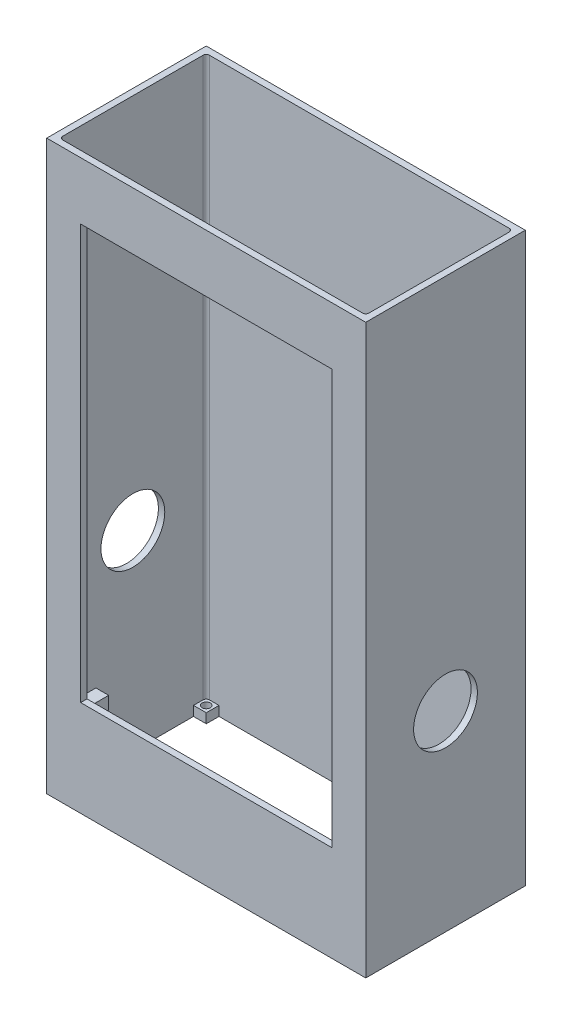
SolidWorks part; units mm, degrees
ref_plane "Front Plane" through (0, 0, 0) normal (0, 0, 1) x (1, 0, 0)
ref_plane "Top Plane" through (0, 0, 0) normal (0, 1, 0) x (1, 0, 0)
ref_plane "Right Plane" through (0, 0, 0) normal (1, 0, 0) x (0, 0, -1)
sketch "Sketch1" plane through (0, 0, 0) normal (0, 1, 0) x (1, 0, 0)
  line L1 (0, 0) -> (127, 0)
  line L2 (0, 0) -> (0, 63.5)
  line L3 (0, 63.5) -> (127, 63.5)
  line L4 (127, 0) -> (127, 63.5)
extrude "Boss-Extrude1" add sketch "Sketch1" against normal blind 302.26
sketch "Sketch2" plane through (0, -302.26, 0) normal (0, -1, 0) x (1, 0, 0)
  line L0 (0, -63.5) -> (0, -60.96)
  line L1 (0, -63.5) -> (0, 0) construction
  line L2 (0, -60.96) -> (2.54, -60.96)
  line L3 (127, 0) -> (127, -2.54)
  line L4 (127, 0) -> (127, -63.5) construction
  line L5 (127, -2.54) -> (124.46, -2.54)
  line L7 (2.54, -60.96) -> (124.46, -60.96)
  line L8 (2.54, -60.96) -> (2.54, -2.54)
  line L9 (2.54, -2.54) -> (124.46, -2.54)
  line L10 (124.46, -60.96) -> (124.46, -2.54)
extrude "Cut-Extrude1" cut sketch "Sketch2" against normal blind 299.72 contours L7 L10 L9 L8
fillet "Fillet3" radius 1.27 1 edges at (2.54, -152.4, -60.96)
fillet "Fillet4" radius 1.27 1 edges at (2.54, -152.4, -2.54)
fillet "Fillet5" radius 1.27 1 edges at (124.46, -152.4, -2.54)
fillet "Fillet6" radius 1.27 1 edges at (124.46, -152.4, -60.96)
sketch "Sketch3" plane through (0, 0, 0) normal (-1, 0, 0) x (0, 0, 1)
  line L0 (-63.5, -302.26) -> (-31.75, -302.26)
  line L1 (-63.5, -302.26) -> (0, -302.26) construction
  line L2 (-31.75, -302.26) -> (-31.75, -152.4)
  circle A0 centre (-31.75, -152.4) radius 12.7
extrude "Cut-Extrude3" cut sketch "Sketch3" against normal blind 254
sketch "Sketch4" plane through (0, 0, 0) normal (0, 1, 0) x (1, 0, 0)
  line L1 (0, 0) -> (127, 0)
  line L2 (0, 0) -> (0, 63.5)
  line L3 (0, 63.5) -> (127, 63.5)
  line L4 (127, 0) -> (127, 63.5)
extrude "Cut-Extrude4" cut sketch "Sketch4" against normal blind 2.54
sketch "Sketch5" plane through (0, 0, 0) normal (0, 0, 1) x (1, 0, 0)
  line L0 (0, -2.54) -> (13.5, -2.54)
  line L1 (0, -2.54) -> (127, -2.54) construction
  line L2 (13.5, -2.54) -> (13.5, -25.4)
  line L3 (127, -2.54) -> (113.5, -2.54)
  line L4 (113.5, -2.54) -> (113.5, -25.4)
  line L5 (13.5, -25.4) -> (113.5, -25.4)
  line L6 (13.5, -25.4) -> (13.5, -190.4)
  line L7 (113.5, -25.4) -> (113.5, -190.4)
  line L8 (113.5, -190.4) -> (13.5, -190.4)
extrude "Cut-Extrude5" cut sketch "Sketch5" against normal blind 25.4 and the other way blind 8.128 contours L8 L7 L5 L6
sketch "Sketch6" plane through (0, 0, -2.54) normal (0, 0, -1) x (-1, 0, 0)
  line L3 (-11.576, -17.86) -> (-9.036, -17.86)
  line L4 (-9.036, -17.86) -> (-9.036, -22.94)
  line L6 (-9.036, -22.94) -> (-14.116, -22.94)
  line L8 (-14.116, -22.94) -> (-14.116, -17.86)
  line L9 (-14.116, -17.86) -> (-11.576, -17.86)
  circle A0 centre (-11.576, -20.4) radius 1.6
extrude "Boss-Extrude3" add sketch "Sketch6" along normal blind 8 contours L3 L4 L6 L8 L9 | A0
sketch "Sketch8" plane through (0, 0, -2.54) normal (0, 0, -1) x (-1, 0, 0)
  line L0 (-113.5, -25.4) -> (-112.884, -25.4)
  line L1 (-13.5, -25.4) -> (-113.5, -25.4) construction
  line L2 (-112.884, -25.4) -> (-112.884, -22.94)
  line L3 (-112.884, -17.86) -> (-117.964, -22.94)
  line L4 (-112.884, -22.94) -> (-117.964, -22.94)
  line L5 (-112.884, -22.94) -> (-112.884, -17.86)
  line L6 (-112.884, -17.86) -> (-117.964, -17.86)
  line L7 (-117.964, -22.94) -> (-117.964, -17.86)
  line L8 (-117.964, -17.86) -> (-112.884, -22.94)
  circle A0 centre (-115.424, -20.4) radius 1.6
extrude "Boss-Extrude4" add sketch "Sketch8" along normal blind 8 contours A0 L8 L7 L3 | A0 L3 L6 L8 | A0 L8 L5 L3 | A0 L3 L4 L8
sketch "Sketch10" plane through (0, 0, -2.54) normal (0, 0, -1) x (-1, 0, 0)
  line L0 (-113.5, -190.4) -> (-112.884, -190.4)
  line L1 (-113.5, -190.4) -> (-13.5, -190.4) construction
  line L2 (-112.884, -190.4) -> (-112.884, -192.86)
  line L3 (-117.964, -192.86) -> (-112.884, -197.94)
  line L4 (-112.884, -192.86) -> (-117.964, -192.86)
  line L5 (-112.884, -192.86) -> (-112.884, -197.94)
  line L6 (-112.884, -197.94) -> (-117.964, -197.94)
  line L7 (-117.964, -192.86) -> (-117.964, -197.94)
  line L8 (-112.884, -192.86) -> (-117.964, -197.94)
  circle A0 centre (-115.424, -195.4) radius 1.6
extrude "Boss-Extrude5" add sketch "Sketch10" along normal blind 8 contours A0 L3 L7 L8 | A0 L8 L4 L3 | A0 L3 L5 L8 | A0 L8 L6 L3
sketch "Sketch11" plane through (0, 0, -2.54) normal (0, 0, -1) x (-1, 0, 0)
  line L0 (-13.5, -190.4) -> (-14.116, -190.4)
  line L1 (-113.5, -190.4) -> (-13.5, -190.4) construction
  line L2 (-14.116, -190.4) -> (-14.116, -192.86)
  line L3 (-14.116, -192.86) -> (-9.036, -197.94)
  line L4 (-14.116, -192.86) -> (-9.036, -192.86)
  line L5 (-14.116, -192.86) -> (-14.116, -197.94)
  line L6 (-14.116, -197.94) -> (-9.036, -197.94)
  line L7 (-9.036, -192.86) -> (-9.036, -197.94)
  line L8 (-14.116, -197.94) -> (-9.036, -192.86)
  circle A0 centre (-11.576, -195.4) radius 1.6
extrude "Boss-Extrude6" add sketch "Sketch11" along normal blind 8 contours A0 L3 L5 L8 | A0 L8 L4 L3 | A0 L3 L7 L8 | A0 L8 L6 L3
sketch "Sketch12" plane through (127, 0, 0) normal (1, 0, 0) x (0, 0, -1)
  line L0 (0, -302.26) -> (0, -2.54) construction
  line L1 (63.5, -302.26) -> (0, -302.26)
  line L2 (63.5, -302.26) -> (63.5, -228.6)
  line L3 (63.5, -228.6) -> (0, -228.6)
  line L4 (0, -302.26) -> (0, -228.6)
extrude "Cut-Extrude6" cut sketch "Sketch12" against normal blind 254 contours L2 L1 L4 L3
sketch "Sketch13" plane through (0, -228.6, 0) normal (0, -1, 0) x (1, 0, 0)
  line L0 (3.81, -2.54) -> (1.6081, -2.54)
  line L1 (2.54, -3.81) -> (2.54, -1.5619)
  line L2 (124.46, -59.69) -> (124.46, -60.96)
  line L3 (7.62, -3.81) -> (7.62, -2.54)
  line L4 (3.81, -2.54) -> (123.19, -2.54) construction
  line L5 (7.62, -2.54) -> (7.62, -7.62)
  line L6 (124.46, -3.81) -> (124.46, -2.54)
  line L7 (7.62, -7.62) -> (2.54, -7.62)
  line L8 (7.62, -7.62) -> (7.62, -2.54)
  line L9 (7.62, -2.54) -> (2.54, -2.54)
  line L10 (2.54, -7.62) -> (2.54, -2.54)
  line L11 (124.46, -2.54) -> (123.19, -2.54)
  line L12 (123.19, -60.96) -> (124.46, -60.96)
  line L13 (124.46, -2.54) -> (119.38, -2.54)
  line L14 (124.46, -2.54) -> (124.46, -7.62)
  line L15 (124.46, -7.62) -> (119.38, -7.62)
  line L16 (119.38, -2.54) -> (119.38, -7.62)
  line L17 (3.81, -60.96) -> (2.54, -60.96)
  line L18 (124.46, -60.96) -> (119.38, -60.96)
  line L19 (124.46, -60.96) -> (124.46, -55.88)
  line L20 (124.46, -55.88) -> (119.38, -55.88)
  line L21 (119.38, -60.96) -> (119.38, -55.88)
  line L22 (2.54, -60.96) -> (2.54, -59.69)
  line L24 (2.54, -60.96) -> (7.62, -60.96)
  line L25 (2.54, -60.96) -> (2.54, -55.88)
  line L26 (2.54, -55.88) -> (7.62, -55.88)
  line L27 (7.62, -60.96) -> (7.62, -55.88)
  arc A0 (124.46, -3.81) -> (123.19, -2.54) centre (123.19, -3.81) ccw construction
  circle A1 centre (5.08, -58.42) radius 1.651
  circle A2 centre (5.08, -5.08) radius 1.651
  circle A3 centre (121.92, -5.08) radius 1.651
  circle A4 centre (121.92, -58.42) radius 1.651
extrude "Boss-Extrude7" add sketch "Sketch13" against normal blind 3.81 contours L7 L5 L3 A2 M32 M39 M38 | L27 L26 A1 M36 M38 M37 | L21 L20 A4 M36 M35 M34 | L16 L15 A3 M32 M34 M33
